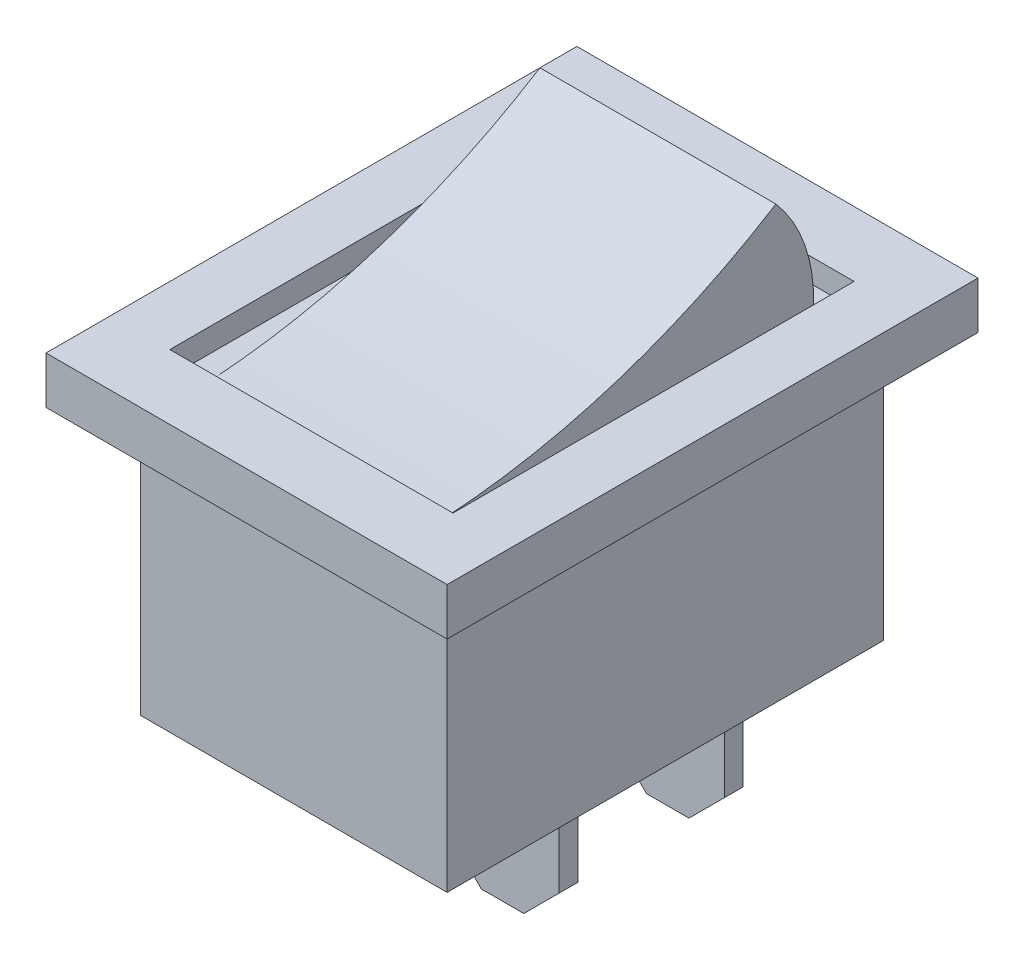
SolidWorks part; units mm, degrees
ref_plane "Front" through (0, 0, 0) normal (0, 0, 1) x (1, 0, 0)
ref_plane "Top" through (0, 0, 0) normal (0, 1, 0) x (1, 0, 0)
ref_plane "Right" through (0, 0, 0) normal (1, 0, 0) x (0, 0, -1)
sketch "Эскиз1" plane through (0, 0, 0) normal (0, 1, 0) x (1, 0, 0)
  line L0 (0, 0) -> (6.5, 0) construction
  line L1 (-6.5, -9.25) -> (6.5, -9.25)
  line L2 (-6.5, -9.25) -> (-6.5, 9.25)
  line L3 (-6.5, 9.25) -> (6.5, 9.25)
  line L4 (6.5, -9.25) -> (6.5, 9.25)
  line L6 (0, 9.25) -> (0, 0) construction
  dimension "D1" = 18.5
  dimension "D2" = 13
extrude "Вытянуть1" add sketch "Эскиз1" along normal blind 11.3
sketch "Эскиз2" plane through (0, 11.3, 0) normal (0, 1, 0) x (-1, 0, 0)
  line L1 (-8.5, -11.25) -> (8.5, -11.25)
  line L2 (-8.5, -11.25) -> (-8.5, 11.25)
  line L3 (-8.5, 11.25) -> (8.5, 11.25)
  line L4 (8.5, -11.25) -> (8.5, 11.25)
  line L5 (0, 0) -> (-5.8278, 0) construction
  line L7 (0, 6.8221) -> (0, 0) construction
  dimension "D1" = 22.5
  dimension "D2" = 17
extrude "Вытянуть2" add sketch "Эскиз2" along normal blind 2
sketch "Эскиз3" plane through (0, 13.3, 0) normal (0, 1, 0) x (-1, 0, 0)
  line L0 (0, 0) -> (-3.8302, 0) construction
  line L1 (-6, -8.5) -> (6, -8.5)
  line L2 (-6, -8.5) -> (-6, 8.5)
  line L3 (-6, 8.5) -> (6, 8.5)
  line L4 (6, -8.5) -> (6, 8.5)
  line L6 (0, -4.5077) -> (0, 0) construction
  dimension "D1" = 17
  dimension "D2" = 12
extrude "Вырез-Вытянуть1" cut sketch "Эскиз3" against normal blind 1
ref_plane "Плоскость1" through (5, 0, 0) normal (1, 0, 0) x (0, 0, -1)
sketch "Эскиз4" plane through (0, 0, 0) normal (1, 0, 0) x (0, 0, -1)
  line L0 (-8.5, 12.3) -> (8.5, 12.3) construction
  line L1 (7.7811, 12.3) -> (-7.7811, 12.3)
  line L2 (-11.25, 11.3) -> (11.25, 11.3) construction
  arc A0 (-7.7811, 12.3) -> (6.1842, 16.8) centre (-9.7201, 42.2373) ccw
  arc A1 (6.1842, 16.8) -> (7.7811, 12.3) centre (1.1839, 12.4922) cw
  point P12 (0, 12.3)
  dimension "D2" = 30
  dimension "D6" = 6.6
  dimension "D1" = 5.5
  dimension "D3" = 15.5622
  dimension "D5" = 1.5969
extrude "Вытянуть3" add sketch "Эскиз4" against normal mid plane 10
sketch "Эскиз5" plane through (0, 0, 0) normal (0, -1, 0) x (1, 0, 0)
  line L0 (0, 0) -> (0, 7.9369) construction
  line L1 (0, 0) -> (5.0977, 0) construction
  line L2 (2.4, 0.4) -> (-2.4, 0.4)
  line L3 (2.4, 0.4) -> (2.4, -0.4)
  line L4 (2.4, -0.4) -> (-2.4, -0.4)
  line L5 (-2.4, 0.4) -> (-2.4, -0.4)
  line L7 (2.4, -6.6) -> (-2.4, -6.6)
  line L8 (2.4, -6.6) -> (2.4, -7.4)
  line L9 (2.4, -7.4) -> (-2.4, -7.4)
  line L10 (-2.4, -6.6) -> (-2.4, -7.4)
  dimension "D1" = 0.8
  dimension "D2" = 4.8
  dimension "D3" = 7
extrude "Вытянуть4" add sketch "Эскиз5" along normal blind 8
chamfer "Фаска1" distance 1.5 angle 45 4 edges at (2.4, -8, -7) (-2.4, -8, -7) (2.4, -8, 0) (-2.4, -8, 0)
